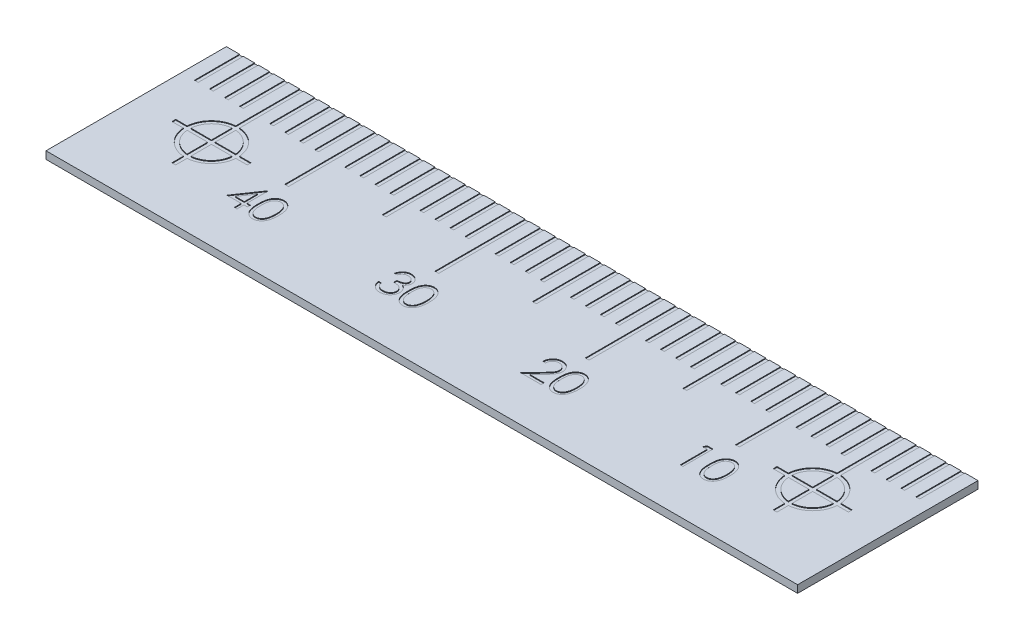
SolidWorks part; units mm, degrees
ref_plane "Front Plane" through (0, 0, 0) normal (0, 0, 1) x (1, 0, 0)
ref_plane "Top Plane" through (0, 0, 0) normal (0, 1, 0) x (1, 0, 0)
ref_plane "Right Plane" through (0, 0, 0) normal (1, 0, 0) x (0, 0, -1)
sketch "Sketch1" plane through (0, 0, 0) normal (0, 1, 0) x (1, 0, 0)
  line L1 (-25, 6) -> (25, 6)
  line L2 (-25, 6) -> (-25, -6)
  line L3 (-25, -6) -> (25, -6)
  line L4 (25, 6) -> (25, -6)
extrude "Boss-Extrude1" add sketch "Sketch1" against normal blind 0.5
sketch "Sketch2" plane through (0, 0, 0) normal (0, 1, 0) x (1, 0, 0)
  line L1 (-24.125, 3) -> (-23.875, 3)
  line L2 (-24.125, 3) -> (-24.125, 6)
  line L3 (-24.125, 6) -> (-23.875, 6)
  line L4 (-23.875, 3) -> (-23.875, 6)
  line L5 (-24, 6) -> (-24, 3) construction
  line L6 (-25, 6) -> (-25, -6) construction
  dimension "D1" = 3
  dimension "D2" = 0.25
  dimension "D3" = 1
extrude "Cut-Extrude2" cut sketch "Sketch2" against normal blind 0.05 contours L4 L3 L2 L1
pattern_linear "LPattern2" count 49 spacing 1 along (1, 0, 0) of "Cut-Extrude2"
sketch "Sketch3" plane through (0, 0, 0) normal (0, 1, 0) x (1, 0, 0)
  line L0 (-15.125, 3) -> (-15.125, 6) construction
  line L6 (-15.125, 3) -> (-14.875, 3)
  line L7 (-15.125, 3) -> (-15.125, 0)
  line L8 (-15.125, 0) -> (-14.875, 0)
  line L9 (-14.875, 3) -> (-14.875, 0)
  dimension "D1" = 0
  dimension "D2" = 0.25
  dimension "D4" = 3
extrude "Cut-Extrude3" cut sketch "Sketch3" against normal blind 0.05
pattern_linear "LPattern3" count 4 spacing 10 along (1, 0, 0) of "Cut-Extrude3"
sketch "Sketch4" plane through (0, 0, 0) normal (0, 1, 0) x (1, 0, 0)
  line L0 (-10.125, 3) -> (-10.125, 6) construction
  line L1 (-10.125, 3) -> (-9.875, 3)
  line L2 (-10.125, 3) -> (-10.125, 1.5)
  line L3 (-10.125, 1.5) -> (-9.875, 1.5)
  line L4 (-9.875, 3) -> (-9.875, 1.5)
  dimension "D1" = 0
  dimension "D2" = 0.25
  dimension "D3" = 3
  dimension "D4" = 1.5
extrude "Cut-Extrude4" cut sketch "Sketch4" against normal blind 0.05
pattern_linear "LPattern4" count 4 spacing 10 along (1, 0, 0) count 2 spacing 10 along (-1, 0, 0) of "Cut-Extrude4"
sketch "Sketch5" plane through (0, 0, 0) normal (0, 1, 0) x (1, 0, 0)
  line L0 (-19.995, 0) -> (-19.995, 2.5) construction
  line L1 (-19.995, 0) -> (-19.995, -2.5) construction
  line L2 (-19.995, 0) -> (-17.495, 0) construction
  line L3 (-19.995, 0) -> (-22.495, 0) construction
  line L5 (-20.12, 2.5) -> (-19.87, 2.5)
  line L6 (-20.12, 2.5) -> (-20.12, 1.7455)
  line L7 (-20.12, -2.5) -> (-19.87, -2.5)
  line L8 (-19.87, 2.5) -> (-19.87, 1.7455)
  line L9 (-22.495, 0.125) -> (-21.7405, 0.125)
  line L10 (-22.495, 0.125) -> (-22.495, -0.125)
  line L11 (-22.495, -0.125) -> (-21.7405, -0.125)
  line L12 (-17.495, 0.125) -> (-17.495, -0.125)
  line L13 (-23.125, 6) -> (-23.875, 6) construction
  line L14 (-20.12, 1.4948) -> (-20.12, 0.125)
  line L15 (-19.87, 1.4948) -> (-19.87, 0.125)
  line L16 (-18.2495, 0.125) -> (-17.495, 0.125)
  line L17 (-18.2495, -0.125) -> (-17.495, -0.125)
  line L18 (-19.87, -1.7455) -> (-19.87, -2.5)
  line L19 (-20.12, -1.7455) -> (-20.12, -2.5)
  line L20 (-21.4898, -0.125) -> (-20.12, -0.125)
  line L21 (-21.4898, 0.125) -> (-20.12, 0.125)
  line L22 (-19.87, -0.125) -> (-19.87, -1.4948)
  line L23 (-19.87, 0.125) -> (-18.5002, 0.125)
  line L24 (-20.12, -0.125) -> (-20.12, -1.4948)
  line L25 (-19.87, -0.125) -> (-18.5002, -0.125)
  arc A0 (-20.12, 1.4948) -> (-21.4898, 0.125) centre (-19.995, 0) ccw
  arc A1 (-20.12, 1.7455) -> (-21.7405, 0.125) centre (-19.995, 0) ccw
  arc A2 (-18.5002, 0.125) -> (-19.87, 1.4948) centre (-19.995, 0) ccw
  arc A3 (-18.2495, 0.125) -> (-19.87, 1.7455) centre (-19.995, 0) ccw
  arc A4 (-19.87, -1.4948) -> (-18.5002, -0.125) centre (-19.995, 0) ccw
  arc A5 (-19.87, -1.7455) -> (-18.2495, -0.125) centre (-19.995, 0) ccw
  arc A6 (-21.4898, -0.125) -> (-20.12, -1.4948) centre (-19.995, 0) ccw
  arc A7 (-21.7405, -0.125) -> (-20.12, -1.7455) centre (-19.995, 0) ccw
  point P34 (-19.995, 2.5)
extrude "Cut-Extrude6" cut sketch "Sketch5" against normal blind 0.05
pattern_linear "LPattern5" count 2 spacing 40 along (1, 0, 0) of "Cut-Extrude6"
sketch "Sketch7" plane through (0, 0, 0) normal (0, 1, 0) x (1, 0, 0)
  line L0 (-25, -6) -> (25, -6) construction
  line L1 (-25, 6) -> (-25, -6) construction
  text T0 "10         20         30         40" font "Century Gothic" height 2
  dimension "D1" = 3
  dimension "D2" = 8.5
extrude "Cut-Extrude7" [suppressed] cut sketch "Sketch7" against normal blind 0.05
sketch "Sketch11" plane through (0, 0, 0) normal (0, 1, 0) x (1, 0, 0)
  line L0 (-25, -6) -> (25, -6) construction
  line L1 (-25, 6) -> (-25, -6) construction
  text T0 "50         60         70         80         90" font "Century Gothic" height 2
  dimension "D1" = 3
  dimension "D2" = 48.5
extrude "Cut-Extrude8" [suppressed] cut sketch "Sketch11" against normal blind 0.05
sketch "Sketch14" plane through (0, 0, 0) normal (0, 1, 0) x (1, 0, 0)
  line L0 (-25, -6) -> (25, -6) construction
  line L1 (-25, 6) -> (-25, -6) construction
  text T0 "100       110       120       130       140" font "Century Gothic" height 2
  dimension "D1" = 3
  dimension "D2" = 97.5
extrude "Cut-Extrude10" [suppressed] cut sketch "Sketch14" against normal blind 0.05
sketch "Sketch15" plane through (0, 0, 0) normal (0, 1, 0) x (1, 0, 0)
  line L0 (-25, 6) -> (-25, -6) construction
  line L1 (-25, -6) -> (25, -6) construction
  text T0 "40         30         20         10" font "Century Gothic" height 2
  dimension "D1" = 8.5
  dimension "D2" = 3
extrude "Cut-Extrude12" cut sketch "Sketch15" against normal blind 0.05
sketch "Sketch18" plane through (0, 0, 0) normal (0, 1, 0) x (1, 0, 0)
  line L0 (-25, -6) -> (25, -6) construction
  line L1 (-25, 6) -> (-25, -6) construction
  text T0 "90         80         70         60         50" font "Century Gothic" height 2
  dimension "D1" = 3
  dimension "D2" = 8.5
extrude "Cut-Extrude13" [suppressed] cut sketch "Sketch18" against normal blind 0.05
sketch "Sketch19" plane through (0, 0, 0) normal (0, 1, 0) x (1, 0, 0)
  line L0 (-25, 6) -> (-25, -6) construction
  line L1 (-25, -6) -> (25, -6) construction
  text T0 "140       130       120       110       100" font "Century Gothic" height 2
  dimension "D1" = 7.5
  dimension "D2" = 3
extrude "Cut-Extrude14" [suppressed] cut sketch "Sketch19" against normal blind 0.05
sketch "Sketch20" plane through (0, 0, 0) normal (0, 1, 0) x (1, 0, 0)
  circle A0 centre (-19.995, 0) radius 1.75
extrude "Cut-Extrude15" [suppressed] cut sketch "Sketch20" against normal blind 0.5
pattern_linear "LPattern6" [suppressed] count 2 spacing 40
sketch "Sketch21" plane through (0, 0, 0) normal (0, 1, 0) x (1, 0, 0)
  line L0 (-25, -6) -> (25, -6) construction
  line L1 (-25, 6) -> (-25, -6) construction
  text T0 "10         20         30         40         50         40         30         20         10" font "Century Gothic" height 2
  dimension "D1" = 3
  dimension "D2" = 8.5
extrude "Cut-Extrude17" [suppressed] cut sketch "Sketch21" against normal blind 0.05
sketch "Sketch22" plane through (0, 0, 0) normal (0, 1, 0) x (1, 0, 0)
  line L0 (-25, -6) -> (25, -6) construction
  line L1 (-25, 6) -> (-25, -6) construction
  text T0 "10         20         30         40         50         60         70         80         90        100        90         80         70         60         50         40         30         20         10" font "Century Gothic" height 2
  dimension "D1" = 3
  dimension "D2" = 8.5
extrude "Cut-Extrude18" [suppressed] cut sketch "Sketch22" against normal blind 0.05
sketch "Sketch23" plane through (0, 0, 0) normal (0, 1, 0) x (1, 0, 0)
  line L0 (-25, -6) -> (25, -6) construction
  line L2 (-25, 6) -> (-25, -6) construction
  text T0 "10         20         30         40         50         60         70         80         90        100       110       120       130       140       150       160       170       180       190       20" font "Century Gothic" height 2
  dimension "D1" = 3
  dimension "D2" = 8.5
extrude "Cut-Extrude19" [suppressed] cut sketch "Sketch23" against normal blind 0.05
sketch "Sketch24" plane through (0, 0, 0) normal (0, 1, 0) x (1, 0, 0)
  line L0 (-25, -6) -> (25, -6) construction
  line L1 (-25, 6) -> (-25, -6) construction
  text T0 "10         20         30         40         50         60         70         80         90        100       110       120       130       140       150       160       170       180       190" font "Century Gothic" height 2
  dimension "D1" = 3
  dimension "D2" = 8.5
extrude "Cut-Extrude20" [suppressed] cut sketch "Sketch24" against normal blind 0.05
sketch "Sketch26" plane through (0, 0, 0) normal (0, 1, 0) x (1, 0, 0)
  line L0 (-25, -6) -> (25, -6) construction
  line L1 (-25, 6) -> (-25, -6) construction
  text T0 "190       180       170       160       150       140       130       120       110       100        90         80         70         60         50         40         30         20         10" font "Century Gothic" height 2
  dimension "D1" = 3
  dimension "D2" = 7.5
extrude "Cut-Extrude21" [suppressed] cut sketch "Sketch26" against normal blind 0.05
sketch "Sketch27" plane through (0, 0, 0) normal (0, 1, 0) x (1, 0, 0)
  line L0 (-25, -6) -> (25, -6) construction
  line L1 (-25, 6) -> (-25, -6) construction
  text T0 "490       480       470       460       450       440       430       420       410       400       390       380       370       360       350       340       330       320       310       300       " font "Century Gothic" height 2
  dimension "D1" = 3
  dimension "D2" = 7.5
extrude "Cut-Extrude22" [suppressed] cut sketch "Sketch27" against normal blind 0.05
sketch "Sketch29" plane through (0, 0, 0) normal (0, 1, 0) x (1, 0, 0)
  line L0 (-25, -6) -> (25, -6) construction
  line L1 (-25, 6) -> (-25, -6) construction
  text T0 "10         20         30         40         50         60         70         80         90        100       110       120       130       140       150       160       170       180       190       20" font "Century Gothic" height 2
  dimension "D1" = 3
  dimension "D2" = 8.5
extrude "Cut-Extrude23" [suppressed] cut sketch "Sketch29" against normal blind 0.05
sketch "Sketch30" plane through (0, 0, 0) normal (0, 1, 0) x (1, 0, 0)
  line L0 (-25, -6) -> (25, -6) construction
  line L1 (-25, 6) -> (-25, -6) construction
  text T0 "240       230       220       210       200       190       180       170       160       150       140       130       120       110       100        90         80         70         60         50   " font "Century Gothic" height 2
  dimension "D1" = 3
  dimension "D2" = 7.5
extrude "Cut-Extrude24" [suppressed] cut sketch "Sketch30" against normal blind 0.05
sketch "Sketch31" [suppressed] plane through (0, 0, 0) normal (0, 1, 0) x (1, 0, 0)
  line L0 (-100, -6) -> (100, -6) construction
  line L1 (-100, 6) -> (-100, -6) construction
  text T0 "150       160       170       180       190" font "Century Gothic" height 2
  dimension "D1" = 3
  dimension "D2" = 148.5
extrude "Cut-Extrude25" [suppressed] cut sketch "Sketch31" against normal blind 0.05
sketch "Sketch32" plane through (0, 0, 0) normal (0, 1, 0) x (1, 0, 0)
  line L0 (-25, -6) -> (25, -6) construction
  line L1 (-24.125, -6) -> (-23.875, -6)
  line L2 (-24.125, -6) -> (-24.125, -3)
  line L3 (-24.125, -3) -> (-23.875, -3)
  line L4 (-23.875, -6) -> (-23.875, -3)
  line L5 (-24, -3) -> (-24, -6) construction
  line L6 (-25, 6) -> (-25, -6) construction
  dimension "D1" = 0.25
  dimension "D2" = 3
  dimension "D3" = 1
extrude "Cut-Extrude26" [suppressed] cut sketch "Sketch32" against normal blind 0.05
pattern_linear "LPattern7" [suppressed] count 99 spacing 1
sketch "Sketch34" [suppressed] plane through (0, 0, 0) normal (0, 1, 0) x (1, 0, 0)
  line L1 (-245.125, -3) -> (-244.875, -3)
  line L2 (-245.125, -3) -> (-245.125, -1.5)
  line L3 (-245.125, -1.5) -> (-244.875, -1.5)
  line L4 (-244.875, -3) -> (-244.875, -1.5)
  dimension "D1" = 1.5
  dimension "D2" = 0.25
extrude "Cut-Extrude27" [suppressed] cut sketch "Sketch34" against normal blind 0.05
pattern_linear "LPattern8" [suppressed] count 4 spacing 10
sketch "Sketch35" [suppressed] plane through (0, 0, 0) normal (0, 1, 0) x (1, 0, 0)
  line L1 (-240.125, -3) -> (-239.875, -3)
  line L2 (-240.125, -3) -> (-240.125, 0)
  line L3 (-240.125, 0) -> (-239.875, 0)
  line L4 (-239.875, -3) -> (-239.875, 0)
  dimension "D1" = 3
  dimension "D2" = 0.25
extrude "Cut-Extrude28" [suppressed] cut sketch "Sketch35" against normal blind 0.05
pattern_linear "LPattern9" [suppressed] count 4 spacing 10
equation "\"D2@Sketch1\"=\"D1@Sketch1\"/2"
equation "\"D4@Sketch1\"=\"D3@Sketch1\"/2"
equation "\"D8@Sketch5\"=\"D7@Sketch5\"/2"
equation "\"D10@Sketch5\"=\"D9@Sketch5\"/2"
